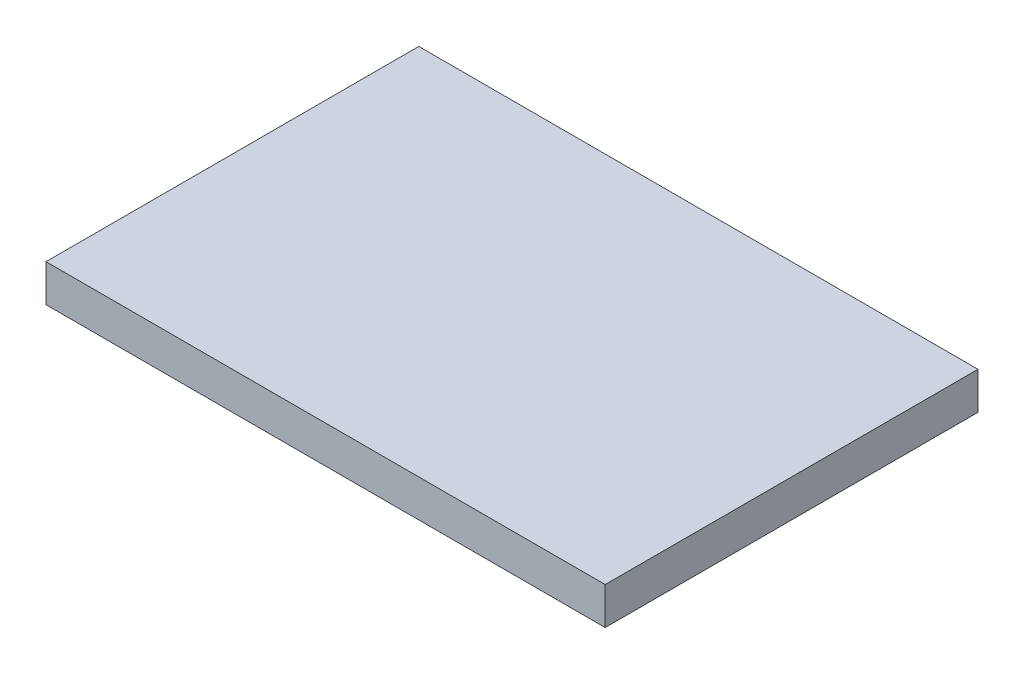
SolidWorks part; units mm, degrees
ref_plane "Front Plane" through (0, 0, 0) normal (0, 0, 1) x (1, 0, 0)
ref_plane "Top Plane" through (0, 0, 0) normal (0, 1, 0) x (1, 0, 0)
ref_plane "Right Plane" through (0, 0, 0) normal (1, 0, 0) x (0, 0, -1)
sketch "Sketch1" plane through (0, 0, 0) normal (0, 1, 0) x (1, 0, 0)
  line L0 (-37.5, 25) -> (37.5, -25) construction
  line L1 (-37.5, 25) -> (37.5, 25)
  line L2 (-37.5, 25) -> (-37.5, -25)
  line L3 (-37.5, -25) -> (37.5, -25)
  line L4 (37.5, 25) -> (37.5, -25)
  dimension "D1" = 50
  dimension "D2" = 75
extrude "Extrude1" add sketch "Sketch1" along normal blind 5
